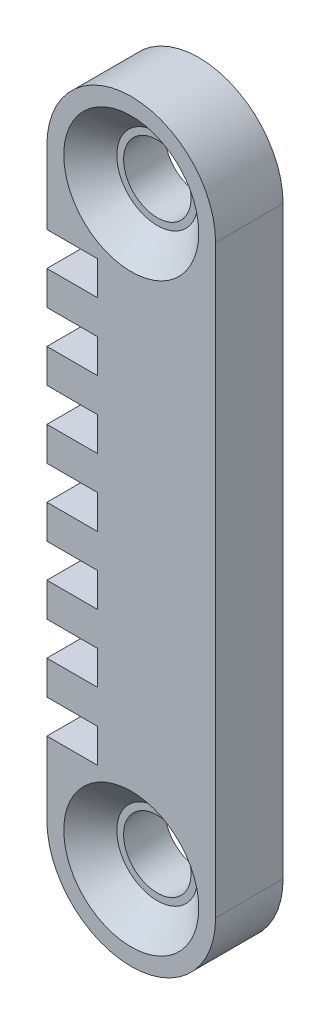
SolidWorks part; units mm, degrees
ref_plane "Ön Düzlem" through (0, 0, 0) normal (0, 0, 1) x (1, 0, 0)
ref_plane "Üst Düzlem" through (0, 0, 0) normal (0, 1, 0) x (1, 0, 0)
ref_plane "Sağ Düzlem" through (0, 0, 0) normal (1, 0, 0) x (0, 0, -1)
sketch "Çizim1" plane through (0, 0, 0) normal (0, 0, 1) x (1, 0, 0)
  line L0 (0, -55) -> (0, 55) construction
  line L1 (-2.2761, 0) -> (48.687, 0) construction
  line L2 (55, 0) -> (-55, 0) construction
  line L3 (-2.5, 8.665) -> (-2.5, 6.5)
  line L4 (2.5, 8.665) -> (2.5, -8.665)
  line L5 (-2.5, 0.5) -> (-1, 0.5)
  line L6 (-1, 0.5) -> (-1, -0.5)
  line L7 (-1, -0.5) -> (-2.5, -0.5)
  line L8 (-2.5, -1.5) -> (-1, -1.5)
  line L9 (-1, -1.5) -> (-1, -2.5)
  line L10 (-1, -2.5) -> (-2.5, -2.5)
  line L11 (-2.5, -3.5) -> (-1, -3.5)
  line L12 (-1, -3.5) -> (-1, -4.5)
  line L13 (-1, -4.5) -> (-2.5, -4.5)
  line L14 (-2.5, -5.5) -> (-1, -5.5)
  line L15 (-1, -5.5) -> (-1, -6.5)
  line L16 (-1, -6.5) -> (-2.5, -6.5)
  line L17 (-2.5, 0.5) -> (-1, 0.5)
  line L18 (-1, 0.5) -> (-1, -0.5)
  line L19 (-1, -0.5) -> (-2.5, -0.5)
  line L20 (-2.5, -1.5) -> (-1, -1.5)
  line L21 (-1, -1.5) -> (-1, -2.5)
  line L22 (-1, -2.5) -> (-2.5, -2.5)
  line L23 (-2.5, -3.5) -> (-1, -3.5)
  line L24 (-1, -3.5) -> (-1, -4.5)
  line L25 (-1, -4.5) -> (-2.5, -4.5)
  line L26 (-2.5, 2.5) -> (-1, 2.5)
  line L27 (-1, 2.5) -> (-1, 1.5)
  line L28 (-1, 1.5) -> (-2.5, 1.5)
  line L29 (-2.5, 0.5) -> (-1, 0.5)
  line L30 (-1, 0.5) -> (-1, -0.5)
  line L31 (-1, -0.5) -> (-2.5, -0.5)
  line L32 (-2.5, -1.5) -> (-1, -1.5)
  line L33 (-1, -1.5) -> (-1, -2.5)
  line L34 (-1, -2.5) -> (-2.5, -2.5)
  line L35 (-2.5, 4.5) -> (-1, 4.5)
  line L36 (-1, 4.5) -> (-1, 3.5)
  line L37 (-1, 3.5) -> (-2.5, 3.5)
  line L38 (-2.5, 2.5) -> (-1, 2.5)
  line L39 (-1, 2.5) -> (-1, 1.5)
  line L40 (-1, 1.5) -> (-2.5, 1.5)
  line L41 (-2.5, 0.5) -> (-1, 0.5)
  line L42 (-1, 0.5) -> (-1, -0.5)
  line L43 (-1, -0.5) -> (-2.5, -0.5)
  line L44 (-2.5, 2.5) -> (-1, 2.5)
  line L45 (-1, 2.5) -> (-1, 1.5)
  line L46 (-1, 1.5) -> (-2.5, 1.5)
  line L47 (-2.5, 4.5) -> (-1, 4.5)
  line L48 (-1, 4.5) -> (-1, 3.5)
  line L49 (-1, 3.5) -> (-2.5, 3.5)
  line L50 (-2.5, 6.5) -> (-1, 6.5)
  line L51 (-1, 6.5) -> (-1, 5.5)
  line L52 (-1, 5.5) -> (-2.5, 5.5)
  line L53 (-2.5, 5.5) -> (-2.5, 4.5)
  line L54 (-2.5, 3.5) -> (-2.5, 2.5)
  line L55 (-2.5, 1.5) -> (-2.5, 0.5)
  line L56 (-2.5, -0.5) -> (-2.5, -1.5)
  line L57 (-2.5, -2.5) -> (-2.5, -3.5)
  line L58 (-2.5, -4.5) -> (-2.5, -5.5)
  line L59 (-2.5, -6.5) -> (-2.5, -8.665)
  circle A0 centre (0, 8.665) radius 1
  circle A1 centre (0, -8.665) radius 1
  arc A2 (-2.5, 8.665) -> (2.5, 8.665) centre (0, 8.665) cw
  arc A3 (2.5, -8.665) -> (-2.5, -8.665) centre (0, -8.665) cw
  point P20 (-1, 0)
  dimension "D2" = 2
  dimension "D3" = 2
  dimension "D1" = 17.33
  dimension "D4" = 5
  dimension "D5" = 1.5
  dimension "D6" = 1
  dimension "D7" = 4
  dimension "D8" = 4
extrude "Yükseklik-Ekstrüzyon1" add sketch "Çizim1" along normal blind 2 contours L6 L1 L4 A2 L3 L50 L51 L52 L53 L35 L36 L37 L54 L26 L27 L28 L55 L5 A0 | L1 L42 L7 L56 L8 L9 L10 L57 L11 L12 L13 L58 L14 L15 L16 L59 A3 L4 A1
other "GelişmişDelik1" parameters "D1"=0
sketch "Çizim2" plane through (0, 0, 2) normal (0, 0, 1) x (1, 0, 0)
  point P0 (0, 8.665)
  point P3 (0, -8.665)
sketch "Çizim3" plane through (0, 8.665, 2) normal (0, 1, 0) x (1, 0, 0)
  line L0 (0, 0) -> (0, 0.7726)
  line L1 (0, -1.9358) -> (0, 5.8073) construction
  line L2 (2, 0) -> (1.2, 0.7726)
  line L3 (-2, 0) -> (-1.2, 0.7726) construction
  line L4 (0, 0) -> (2, 0)
  line L5 (1.2, 0.7726) -> (0, 0.7726)
  dimension "D1" = 0.7726
  dimension "D2" = 4
  dimension "D3" = 92
